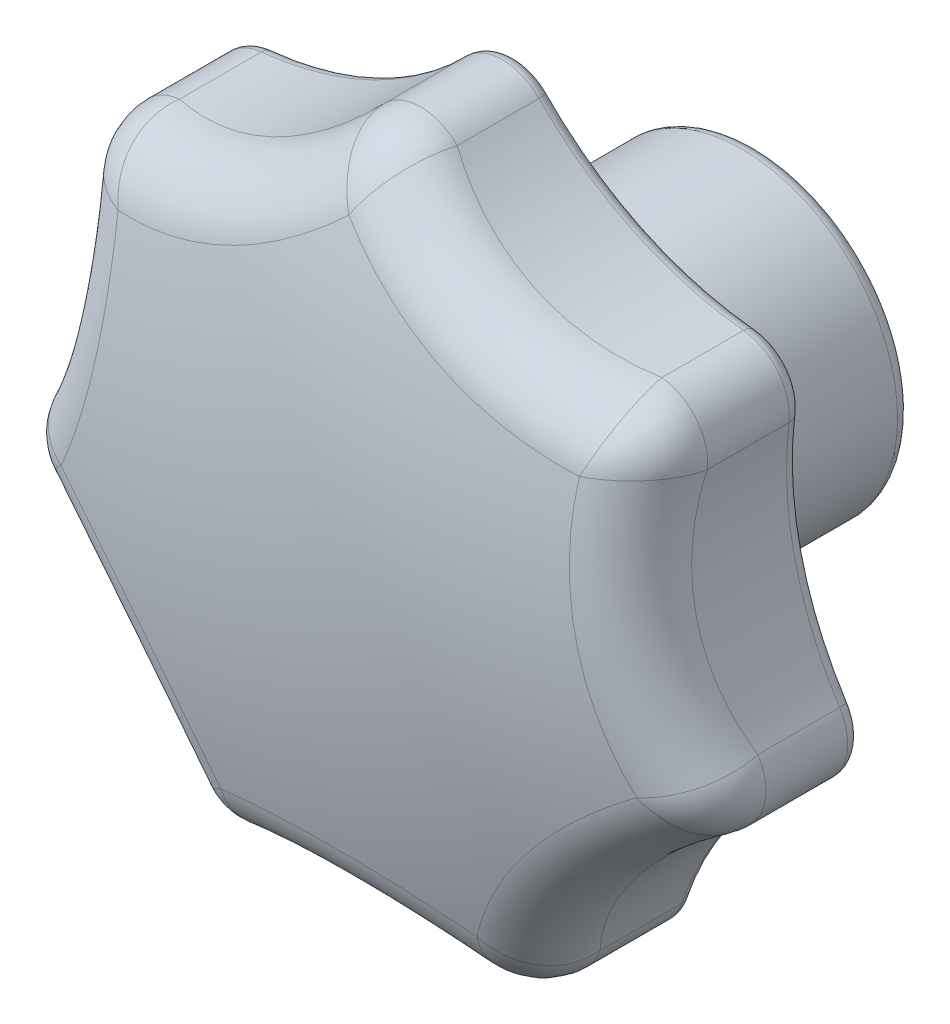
SolidWorks part; units mm, degrees
ref_plane "Plan de face" through (0, 0, 0) normal (0, 0, 1) x (1, 0, 0)
ref_plane "Plan de dessus" through (0, 0, 0) normal (0, 1, 0) x (1, 0, 0)
ref_plane "Plan de droite" through (0, 0, 0) normal (1, 0, 0) x (0, 0, -1)
imported_body "Importée3"
sketch "Esquisse1" plane through (0, 0, 13.29) normal (0, 0, -1) x (-1, 0, 0)
  arc A0 (-12.703, -20.4231) -> (-22.7377, -7.84) centre (-35.0546, -27.9551) ccw
  arc A1 (-22.7377, -7.84) -> (-23.8876, -2.8019) centre (-20.8513, -4.7592) cw
  arc A2 (-23.8876, -2.8019) -> (-20.3063, 12.8889) centre (-43.7123, 9.9771) ccw
  arc A3 (-20.3063, 12.8889) -> (-17.0843, 16.9291) centre (-16.7214, 13.3349) cw
  arc A4 (-17.0843, 16.9291) -> (-2.5838, 23.9122) centre (-19.4538, 40.3963) ccw
  arc A5 (-2.5838, 23.9122) -> (2.5838, 23.9122) centre (0, 21.3875) cw
  arc A6 (2.5838, 23.9122) -> (17.0843, 16.9291) centre (19.4538, 40.3963) ccw
  arc A7 (17.0843, 16.9291) -> (20.3063, 12.8889) centre (16.7214, 13.3349) cw
  arc A8 (20.3063, 12.8889) -> (23.8876, -2.8019) centre (43.7123, 9.9771) ccw
  arc A9 (23.8876, -2.8019) -> (22.7377, -7.84) centre (20.8513, -4.7592) cw
  arc A10 (22.7377, -7.84) -> (12.703, -20.4231) centre (35.0546, -27.9551) ccw
  arc A11 (12.703, -20.4231) -> (8.0472, -22.6652) centre (9.2797, -19.2695) cw
  arc A12 (8.0472, -22.6652) -> (-8.0472, -22.6652) centre (0, -44.8365) ccw
  arc A13 (-8.0472, -22.6652) -> (-12.703, -20.4231) centre (-9.2797, -19.2695) cw
extrude "Boss.-Extru.1" add sketch "Esquisse1" along normal blind 6.79
ref_plane "Plan1" through (0, 0, 0) normal (0, -1, 0) x (1, 0, 0)
sketch "Esquisse2" plane through (0, 0, 0) normal (0, -1, 0) x (1, 0, 0)
  line L0 (11, 6.5) -> (0, 6.5)
  line L1 (0, 6.5) -> (0, -10.5)
  line L2 (0, -10.5) -> (11, -10.5)
  line L3 (11, -10.5) -> (11, 6.5)
  line L4 (0, 6.5) -> (0, -10.5) construction
revolve "Révolution1" add sketch "Esquisse2" angle 360 about L4
hole_wizard "Diamètre du perçage Ø11.5 (11.5)1" positions "Esquisse4" profile "Esquisse3" hole size "Ø11.5" standard "Ansi Metric"
sketch "Esquisse4" plane through (0, 0, -10.5) normal (0, 0, -1) x (-1, 0, 0)
  point P0 (0, 0)
sketch "Esquisse3" plane through (0, 0, -10.5) normal (1, 0, 0) x (0, 1, 0)
  line L0 (0, 0) -> (0, 21.75)
  line L1 (0, 21.75) -> (5.75, 21.75)
  line L2 (5.75, 21.75) -> (5.75, 0)
  line L5 (5.75, 0) -> (0, 0)
  line L10 (0, 21.75) -> (-5.75, 21.75) construction
  line L11 (0, -6.35) -> (0, 107.95) construction
  dimension "Diamètre du perçage" = 11.5
  dimension "Profondeur du perçage" = 21.75
  dimension "Angle de pointe" = 180
fillet "Congé1" radius 1 15 edges at (-19.5458, 15.5872, 6.5) (-20.7172, 4.7286, 6.5) (-9.22, 19.1456, 6.5) (-24.3732, -5.563, 6.5) (0, 25, 6.5) (-16.6139, -13.2492, 6.5) (9.22, 19.1456, 6.5) (-10.8471, -22.5242, 6.5) (19.5458, 15.5872, 6.5) (0, -21.25, 6.5) (20.7172, 4.7286, 6.5) (10.8471, -22.5242, 6.5) (24.3732, -5.563, 6.5) (16.6139, -13.2492, 6.5) (0, 11, -10.5)
imported_body "Importée4"
